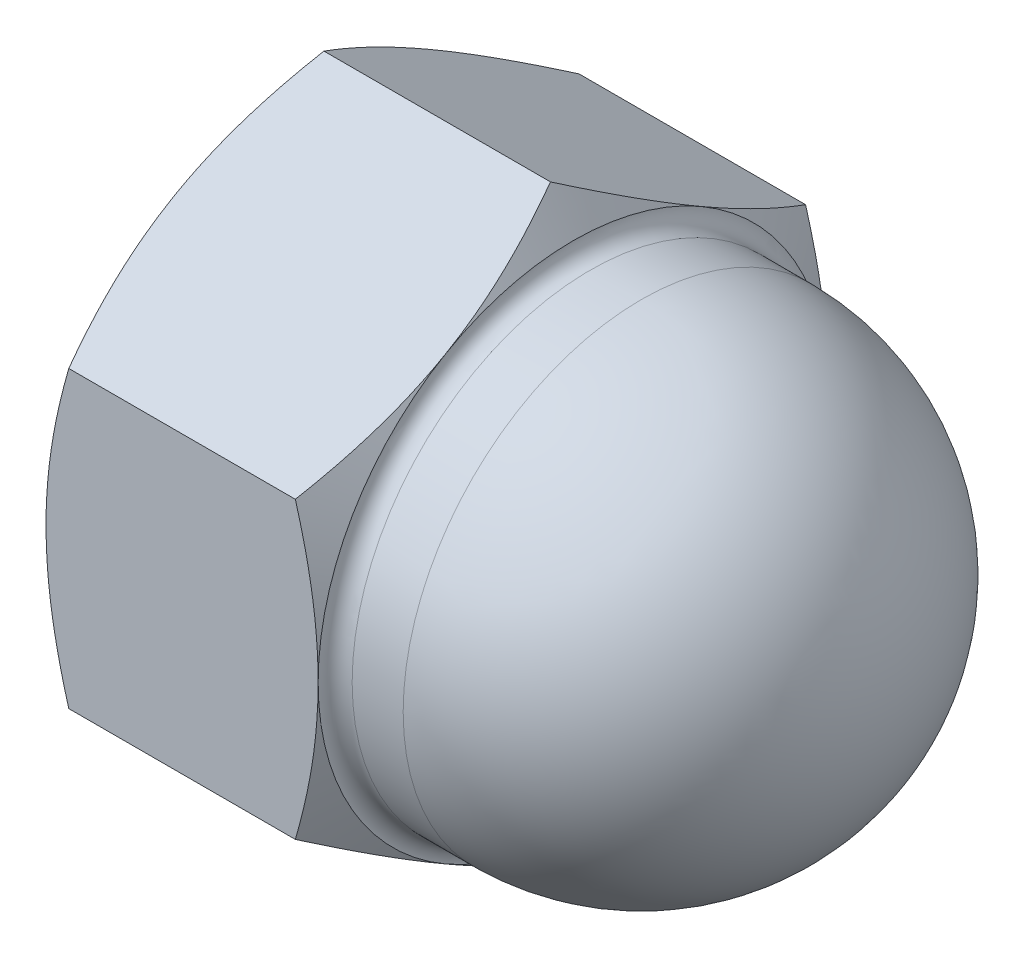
SolidWorks part; units mm, degrees
extrude "BaseNut" add sketch "BaseNutSke" along normal blind 16
sketch "BaseNutSke" plane through (0, 0, 0) normal (1, 0, 0) x (0, 0, -1)
  line L6 (15, 8.6603) -> (15, -8.6603)
  line L7 (-15, 8.6603) -> (-15, -8.6603)
  line L8 (15, 8.6603) -> (0, 17.3205)
  line L9 (0, 17.3205) -> (-15, 8.6603)
  line L10 (-15, -8.6603) -> (0, -17.3205)
  line L11 (0, -17.3205) -> (15, -8.6603)
  dimension "D4" = 60
  dimension "D1" = 120
  dimension "D2" = 15
  dimension "D3" = 15
  dimension "Width_flats" = 30
revolve "DoubleChamfer" cut sketch "Sketch4" angle 360 about L10
sketch "Sketch4" plane through (0, 0, 0) normal (0, 0, 1) x (1, 0, 0)
  line L0 (0, 15) -> (2.7831, 19.8205)
  line L1 (16, 15) -> (13.2169, 19.8205)
  line L2 (2.7831, 19.8205) -> (13.2169, 19.8205)
  line L3 (16, 15) -> (18, 15)
  line L4 (18, 15) -> (18, 30)
  line L5 (18, 30) -> (-2, 30)
  line L6 (0, 15) -> (-2, 15)
  line L7 (-2, 15) -> (-2, 30)
  line L8 (16, 17.3205) -> (16, 8.6603) construction
  line L9 (0, 17.3205) -> (0, 8.6603) construction
  line L10 (0, 0) -> (57.15, 0) construction
  line L11 (16, 17.3205) -> (0, 17.3205) construction
  point P17 (16, 15)
  dimension "D1" = 30
  dimension "D2" = 30
  dimension "D3" = 2
  dimension "D4" = 2
  dimension "D5" = 2.5
  dimension "D6" = 15
  dimension "D7" = 15
revolve "TapDrill" cut sketch "TapDriSke"
sketch "TapDriSke" plane through (0, 0, 0) normal (0, 0, 1) x (1, 0, 0)
  line L0 (0, 0) -> (44.45, 0) construction
  line L1 (0, 8.75) -> (23, 8.75)
  line L2 (0, 12.9904) -> (0, 0) construction
  line L3 (23, 8.75) -> (28.2575, 0)
  line L4 (0, 0) -> (63.5, 0) construction
  line L5 (28.2575, 0) -> (0, 0)
  line L6 (0, 0) -> (0, 8.75)
  line L7 (23, -8.75) -> (28.2575, 0) construction
  line L8 (0, -8.75) -> (23, -8.75) construction
  line L9 (2.5, 6.35) -> (2.5, 3.175) construction
revolve "EndChamfer" cut sketch "EndChamferSketch" angle 360 about L4
sketch "EndChamferSketch" plane through (0, 0, 0) normal (0, 0, 1) x (1, 0, 0)
  line L0 (-0.0254, 10) -> (0.0254, 10)
  line L1 (0.0254, 10) -> (0.9882, 8.625)
  line L2 (0.9882, 8.625) -> (-0.0254, 8.625)
  line L3 (-0.0254, 8.625) -> (-0.0254, 10)
  line L4 (0, 0) -> (-15.875, 0) construction
  dimension "D1" = 0.0508
  dimension "D2" = 35
  dimension "D3" = 0.0254
  dimension "ChamferDepth" = 1.375
  dimension "ThreadMajor" = 10
revolve "Undercut" cut sketch "UcutSke" angle 360 about L0
sketch "UcutSke" plane through (0, 0, 0) normal (0, 0, 1) x (1, 0, 0)
  line L0 (0, 0) -> (38.1, 0) construction
  line L1 (17.8994, 10.1) -> (17.12, 8.75)
  line L2 (17.12, 0.25) -> (26.42, 0.25)
  line L3 (26.42, 0.25) -> (26.42, 10.1)
  line L4 (26.42, 10.1) -> (17.8994, 10.1)
  line L5 (17.12, 0.25) -> (17.12, 8.75)
  line L6 (23, 8.75) -> (0, 8.75) construction
  line L7 (0, 12.9904) -> (0, 0) construction
ref_plane "Plane1" through (0, 0, 0) normal (0, 0, 1) x (1, 0, 0)
ref_plane "Plane2" through (0, 0, 0) normal (0, 1, 0) x (1, 0, 0)
ref_plane "Plane3" through (0, 0, 0) normal (1, 0, 0) x (0, 0, -1)
other "Configuration Table"
sketch "DomeSke" plane through (0, 0, 0) normal (0, 0, 1) x (1, 0, 0)
  line L0 (0, 0) -> (63.5, 0) construction
  line L1 (0, 8.6603) -> (0, -8.6603) construction
  line L2 (34, 0) -> (0, 0)
  line L3 (0, 14) -> (20, 14)
  line L4 (0, -14) -> (22.225, -14) construction
  line L5 (0, 14) -> (0, 0)
  arc A0 (20, 14) -> (34, 0) centre (20, 0) cw
revolve "Dome" add sketch "DomeSke" angle 360 about L0
sketch "ThdSchSke" plane through (0, 0, 0) normal (0, 1, 0) x (1, 0, 0)
  line L0 (0.0381, 10) -> (-0.8372, 8.75)
  line L1 (-0.8372, 8.75) -> (-0.8372, 4.375)
  line L2 (-0.8372, 4.375) -> (0.9134, 4.375)
  line L3 (0.9134, 4.375) -> (0.9134, 8.75)
  line L4 (0.9134, 8.75) -> (0.0381, 10)
  line L5 (-38.1, 0) -> (3.175, 0) construction
  line L6 (0, 0) -> (-15.875, 0) construction
  line L7 (0, 0) -> (63.5, 0) construction
  line L9 (2.5381, 0.475) -> (2.5381, -5.875) construction
revolve "ThreadSchematic" [suppressed] cut sketch "ThdSchSke" angle 360 about L5
pattern_linear "ThdSchPat" [suppressed]
fillet "DomeFillet" radius 1 1 edges at (16, 0, 14)
equation "' \"Width_flats@BaseNutSke\" = 30"
equation "' \"Hex_ht@BaseNut\" = 16"
equation "' \"Overall_ht@DomeSke\" = 34"
equation "' \"Dome_rad@DomeSke\" = 14"
equation "' \"Thread_min@TapDriSke\" = 17.5"
equation "' \"Drill_clr@TapDriSke\" = 5.0"
equation "' \"Advance@ThdSchSke\" = 2.5"
equation "' \"Thread_nominal@ThreadCosmetic\" = 20"
equation "' \"Radius@DomeFillet\" = 0.5"
equation "' \"Ucut_wid@UcutSke\" = 9.3"
equation "' \"Ucut_dep@UcutSke\" = 26.42"
equation "\"Drill_depth@TapDriSke\" = \"Overall_ht@DomeSke\"  - \"Drill_clr@TapDriSke\" - 0.3 * \"Thread_nominal@ThreadCosmetic\""
equation "\"Ucut_dia@UcutSke\" = \"Thread_nominal@ThreadCosmetic\" * 1.01"
equation "\"Thread_depth@ThreadCosmetic\" = \"Ucut_dep@UcutSke\" - \"Ucut_wid@UcutSke\" + ( \"Thread_nominal@ThreadCosmetic\" - \"Thread_min@TapDriSke\" ) / 2 * 0.57735"
equation "\"D2@BaseNutSke\" = \"Width_flats@BaseNutSke\" / 2"
equation "\"D3@BaseNutSke\" = \"Width_flats@BaseNutSke\" / 2"
equation "\"D7@Sketch4\" = \"Width_flats@BaseNutSke\" / 2"
equation "\"D5@Sketch4\" = \"Width_flats@BaseNutSke\" / 12"
equation "\"Thread_major@ThdSchSke\" = \"Thread_nominal@ThreadCosmetic\""
equation "\"Tap_drill@ThdSchSke\" = \"Thread_min@TapDriSke\""
equation "\"OverCut@ThdSchSke\" = \"Tap_drill@ThdSchSke\" * 0.5"
equation "\"Num_threads@ThdSchPat\" = int(  ( \"Thread_depth@ThreadCosmetic\" - 0.002 ) / \"Advance@ThdSchSke\" + 0.999 )  + 1"
equation "\"Advance@ThdSchPat\" = ( \"Thread_depth@ThreadCosmetic\" - 0.002 ) /  (\"Num_threads@ThdSchPat\" - 1) 'relax it"
equation "\"ThreadMajor@EndChamferSketch\" = \"Thread_nominal@ThreadCosmetic\" * 0.5"
equation "\"ChamferDepth@EndChamferSketch\" = (\"Thread_nominal@ThreadCosmetic\" - \"Thread_min@TapDriSke\") * 0.55"
